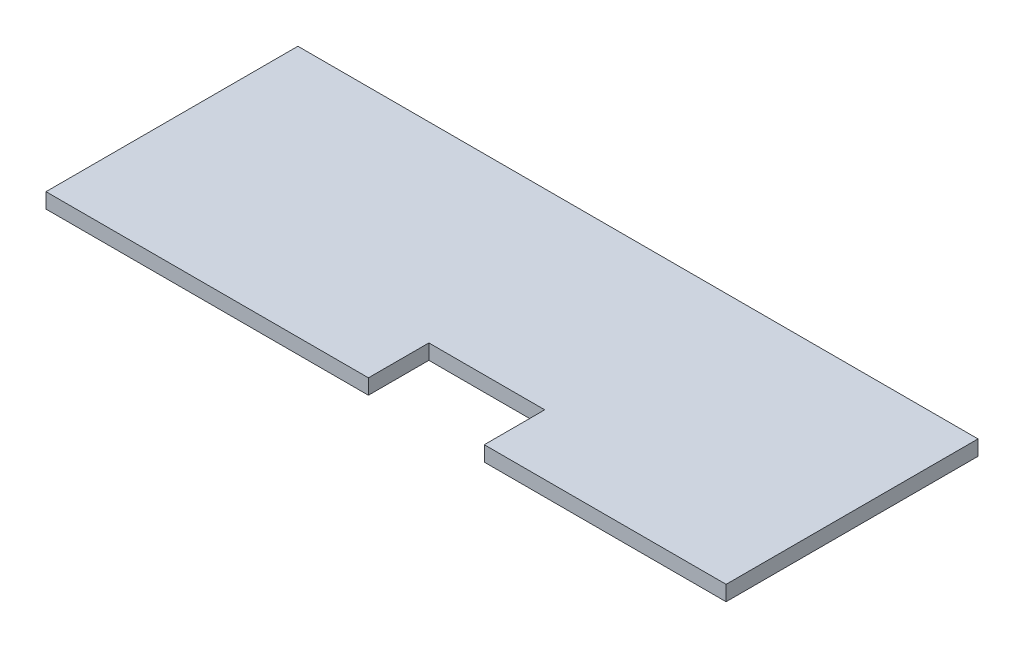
SolidWorks part; units mm, degrees
ref_plane "Front Plane" through (0, 0, 0) normal (0, 0, 1) x (1, 0, 0)
ref_plane "Top Plane" through (0, 0, 0) normal (0, 1, 0) x (1, 0, 0)
ref_plane "Right Plane" through (0, 0, 0) normal (1, 0, 0) x (0, 0, -1)
sketch "Sketch1" plane through (0, 0, 0) normal (0, 1, 0) x (1, 0, 0)
  line L1 (-67.5, -25) -> (67.5, -25)
  line L2 (-67.5, -25) -> (-67.5, 25)
  line L3 (-67.5, 25) -> (67.5, 25)
  line L4 (67.5, -25) -> (67.5, 25)
  line L5 (-67.5, -25) -> (67.5, 25) construction
  line L6 (-67.5, 25) -> (67.5, -25) construction
  line L7 (-3.5, -25) -> (19.5, -25)
  line L8 (-3.5, -25) -> (-3.5, -13)
  line L9 (-3.5, -13) -> (19.5, -13)
  line L10 (19.5, -25) -> (19.5, -13)
  point P0 (0, 0)
  dimension "D1" = 135
  dimension "D2" = 50
  dimension "D3" = 12
  dimension "D4" = 23
  dimension "D5" = 48
extrude "Boss-Extrude1" add sketch "Sketch1" along normal blind 3 contours L10 L1 L4 L3 L2 L8 L9
